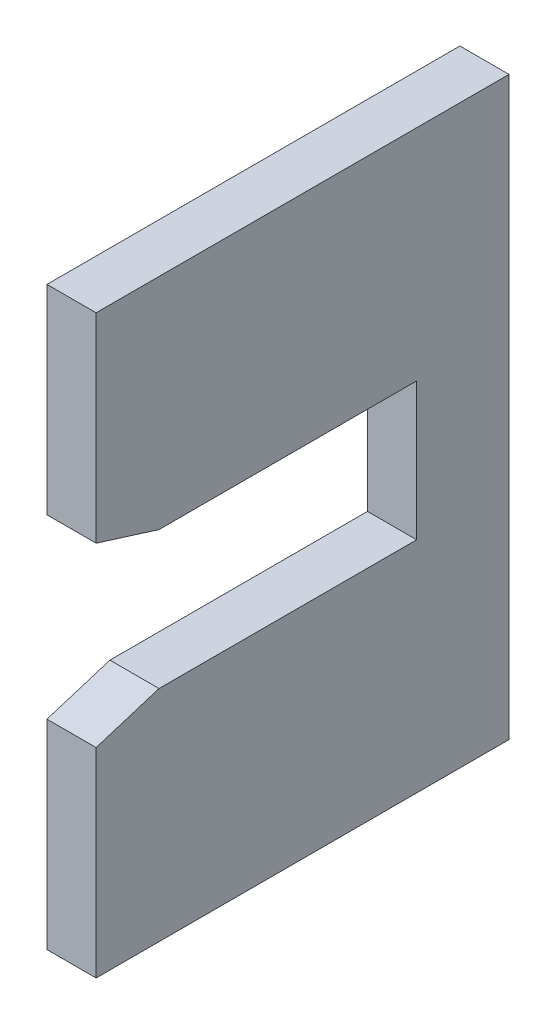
SolidWorks part; units mm, degrees
ref_plane "Plan de face" through (0, 0, 0) normal (0, 0, 1) x (1, 0, 0)
ref_plane "Plan de dessus" through (0, 0, 0) normal (0, 1, 0) x (1, 0, 0)
ref_plane "Plan de droite" through (0, 0, 0) normal (1, 0, 0) x (0, 0, -1)
sketch "Esquisse1" plane through (0, 0, 0) normal (0, 0, 1) x (1, 0, 0)
  line L0 (16.8121, -6.5586) -> (16.8121, -57.131) construction
  line L3 (16.8121, -6.5586) -> (14.3121, -6.5586)
  line L4 (16.8121, -6.5586) -> (16.8121, -35.8586)
  line L5 (16.8121, -35.8586) -> (14.3121, -35.8586)
  line L6 (14.3121, -6.5586) -> (14.3121, -35.8586)
  dimension "D1" = 2.5
  dimension "D2" = 29.3
extrude "Extrusion1" add sketch "Esquisse1" along normal blind 21
sketch "Esquisse2" plane through (16.8121, 0, 0) normal (1, 0, 0) x (0, 0, -1)
  line L0 (-21, -21.2086) -> (8.7684, -21.2086) construction
  line L1 (-21, -35.8586) -> (-21, -6.5586) construction
  line L2 (-17.8, -17.7086) -> (-4.6973, -17.7086)
  line L3 (-4.6973, -17.7086) -> (-4.6973, -24.7086)
  line L4 (-21, -16.7086) -> (-21, -25.7086)
  line L5 (-21, -16.7086) -> (-17.8, -17.7086)
  line L6 (-21, -25.7086) -> (-17.8, -24.7086)
  line L7 (-17.8, -24.7086) -> (-4.6973, -24.7086)
  point P11 (-4.6973, -21.2086)
  dimension "D1" = 7
  dimension "D3" = 1
extrude "Enlèv. mat.-Extru.1" cut sketch "Esquisse2" against normal through all
